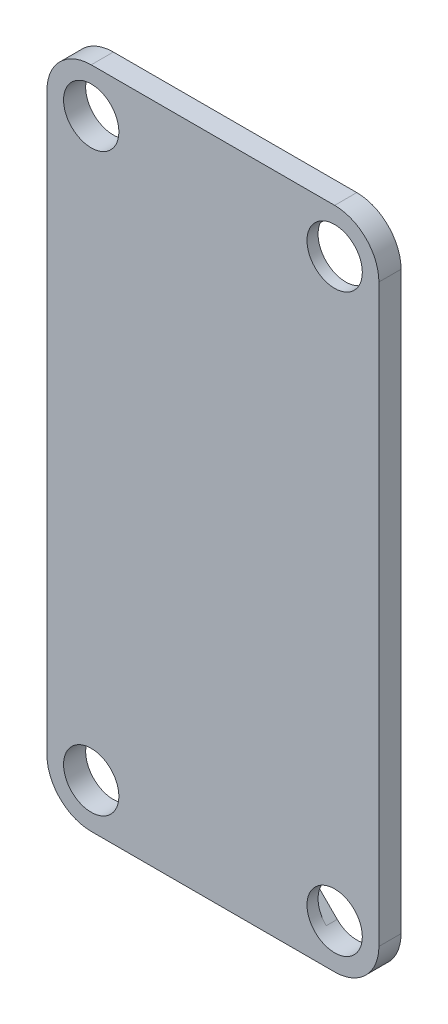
SolidWorks part; units mm, degrees
ref_plane "Plan de face" through (0, 0, 0) normal (0, 0, 1) x (1, 0, 0)
ref_plane "Plan de dessus" through (0, 0, 0) normal (0, 1, 0) x (1, 0, 0)
ref_plane "Plan de droite" through (0, 0, 0) normal (1, 0, 0) x (0, 0, -1)
sketch "Esquisse1" plane through (0, 0, 0) normal (0, 0, 1) x (1, 0, 0)
  line L0 (-220, -600) -> (220, -600)
  line L1 (300, -520) -> (300, 520)
  line L2 (220, 600) -> (-220, 600)
  line L3 (-300, 520) -> (-300, -520)
  arc A0 (-300, -520) -> (-220, -600) centre (-220, -520) ccw
  arc A1 (220, -600) -> (300, -520) centre (220, -520) ccw
  arc A2 (300, 520) -> (220, 600) centre (220, 520) ccw
  arc A3 (-220, 600) -> (-300, 520) centre (-220, 520) ccw
  circle A4 centre (-220, -520) radius 50
  circle A5 centre (220, -520) radius 50
  circle A6 centre (220, 520) radius 50
  circle A7 centre (-220, 520) radius 50
extrude "Boss.-Extru.1" add sketch "Esquisse1" along normal blind 40
sketch "Esquisse2" plane through (0, 0, 0) normal (0, 0, -1) x (-1, 0, 0)
  line L0 (-270, -520) -> (-270, 520)
  line L1 (-184.6447, -555.3553) -> (230, -140.7107)
  line L2 (230, 135.7172) -> (-200.1917, 565.9089)
  line L3 (230, -140.7107) -> (230, 135.7172)
  line L12 (220, -600) -> (-220, -600) construction
  line L13 (-220, 600) -> (220, 600) construction
  circle A14 centre (-220, 520) radius 50 construction
  circle A15 centre (-220, -520) radius 50 construction
  arc A16 (-174.0911, 539.8083) -> (-270, 520) centre (-220, 520) ccw
  arc A17 (-270, -520) -> (-184.6447, -555.3553) centre (-220, -520) ccw
  dimension "D1" = 230
  dimension "D2" = 45
  dimension "D3" = 45
extrude "Enlèv. mat.-Extru.2" cut sketch "Esquisse2" against normal blind 20 contours L1 L3 L2 L0 M19 M18
